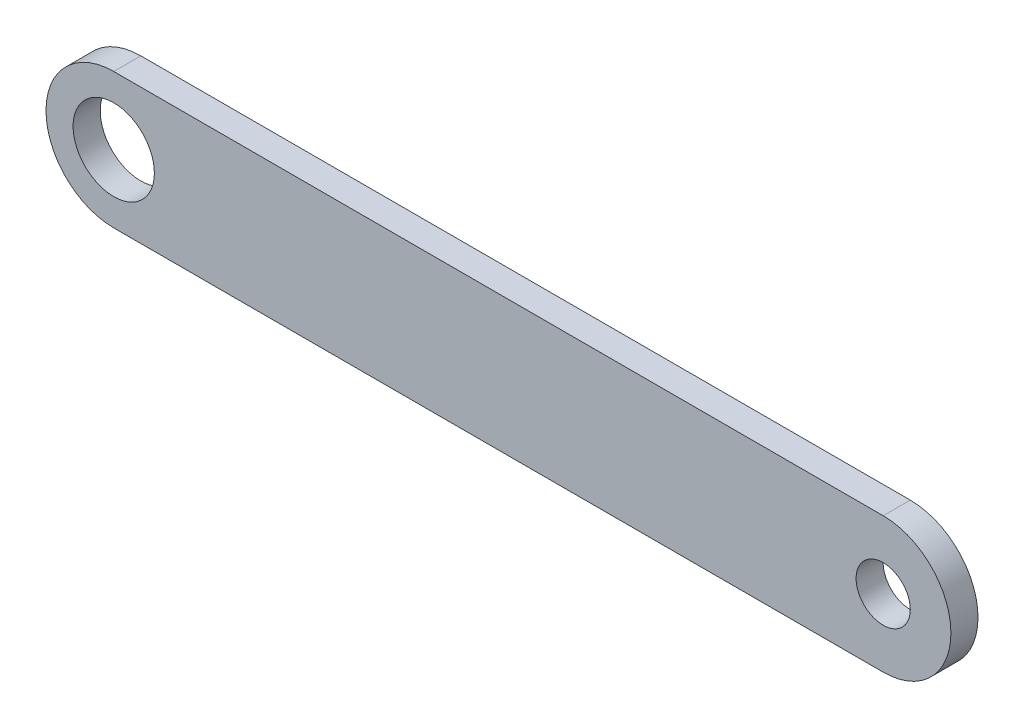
SolidWorks part; units mm, degrees
ref_plane "Front Plane" through (0, 0, 0) normal (0, 0, 1) x (1, 0, 0)
ref_plane "Top Plane" through (0, 0, 0) normal (0, 1, 0) x (1, 0, 0)
ref_plane "Right Plane" through (0, 0, 0) normal (1, 0, 0) x (0, 0, -1)
sketch "Sketch1" plane through (0, 0, 0) normal (0, 0, 1) x (1, 0, 0)
  line L0 (-71, 0) -> (71, 0) construction
  line L1 (-71, 12.5) -> (71, 12.5)
  line L2 (-71, -12.5) -> (71, -12.5)
  arc A0 (-71, 12.5) -> (-71, -12.5) centre (-71, 0) ccw
  arc A1 (71, -12.5) -> (71, 12.5) centre (71, 0) ccw
  point P2 (0, 0)
  dimension "D1" = 142
  dimension "D3" = 25
extrude "Boss-Extrude1" add sketch "Sketch1" along normal blind 5
hole_wizard "M14 Clearance Hole1" positions "Sketch4" profile "Sketch5" hole size "M14" standard "ANSI Metric"
sketch "Sketch4" plane through (0, 0, 5) normal (0, 0, 1) x (1, 0, 0)
  point P0 (-71, 0)
sketch "Sketch5" plane through (-71, 0, 5) normal (1, 0, 0) x (0, -1, 0)
  line L0 (0, 0) -> (0, 5)
  line L1 (0, 5) -> (7.5, 5)
  line L2 (7.5, 5) -> (7.5, 0)
  line L5 (7.5, 0) -> (0, 0)
  line L11 (0, -6.35) -> (0, 107.95) construction
  dimension "Thru Hole Dia." = 15
  dimension "Thru Hole Depth" = 5
hole_wizard "M8 Clearance Hole1" positions "Sketch6" profile "Sketch7" hole size "M8" standard "ANSI Metric"
sketch "Sketch6" plane through (0, 0, 5) normal (0, 0, 1) x (1, 0, 0)
  point P0 (71, 0)
sketch "Sketch7" plane through (71, 0, 5) normal (1, 0, 0) x (0, -1, 0)
  line L0 (0, 0) -> (0, 5)
  line L1 (0, 5) -> (5, 5)
  line L2 (5, 5) -> (5, 0)
  line L5 (5, 0) -> (0, 0)
  line L11 (0, -6.35) -> (0, 107.95) construction
  dimension "Thru Hole Dia." = 10
  dimension "Thru Hole Depth" = 5
